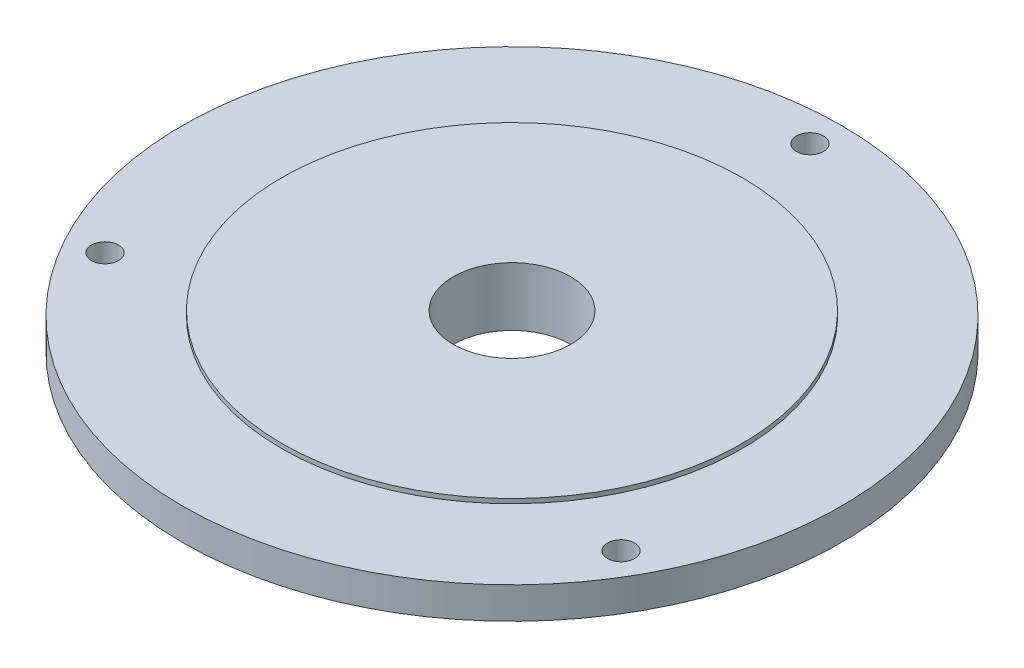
SolidWorks part; units mm, degrees
ref_plane "Piano frontale" through (0, 0, 0) normal (0, 0, 1) x (1, 0, 0)
ref_plane "Piano superiore" through (0, 0, 0) normal (0, 1, 0) x (1, 0, 0)
ref_plane "Piano destro" through (0, 0, 0) normal (1, 0, 0) x (0, 0, -1)
sketch "Schizzo1" plane through (0, 0, 0) normal (0, 0, 1) x (1, 0, 0)
  line L0 (0, 0) -> (0, 68.8521) construction
  line L4 (36.5, 37.8859) -> (36.5, 34.3859)
  line L10 (14.25, 34.3859) -> (36.5, 34.3859)
  line L15 (6.5, 38.3859) -> (25.5, 38.3859)
  line L16 (25.5, 38.3859) -> (25.5, 37.8859)
  line L17 (6.5, 31.8859) -> (6.5, 38.3859)
  line L18 (25.5, 37.8859) -> (36.5, 37.8859)
  line L19 (6.5, 31.8859) -> (14.25, 31.8859)
  line L20 (14.25, 31.8859) -> (14.25, 34.3859)
  dimension "D1" = 25.5
  dimension "D2" = 36.5
  dimension "D3" = 2.5
  dimension "D4" = 0.5
  dimension "D5" = 6.5
  dimension "D6" = 3.5
  dimension "D7" = 14.25
revolve "Rivoluzione1" add sketch "Schizzo1" angle 360 about L0
sketch "Schizzo2" plane through (0, 37.8859, 0) normal (0, 1, 0) x (1, 0, 0)
  circle A0 centre (0, 33) radius 1.5
  circle A1 centre (28.5788, -16.5) radius 1.5
  circle A2 centre (-28.5788, -16.5) radius 1.5
  point P10 (0, 0)
  dimension "D1" = 3
  dimension "D2" = 33
  dimension "D3" = 3
extrude "Taglio-Estrusione1" cut sketch "Schizzo2" against normal through all
